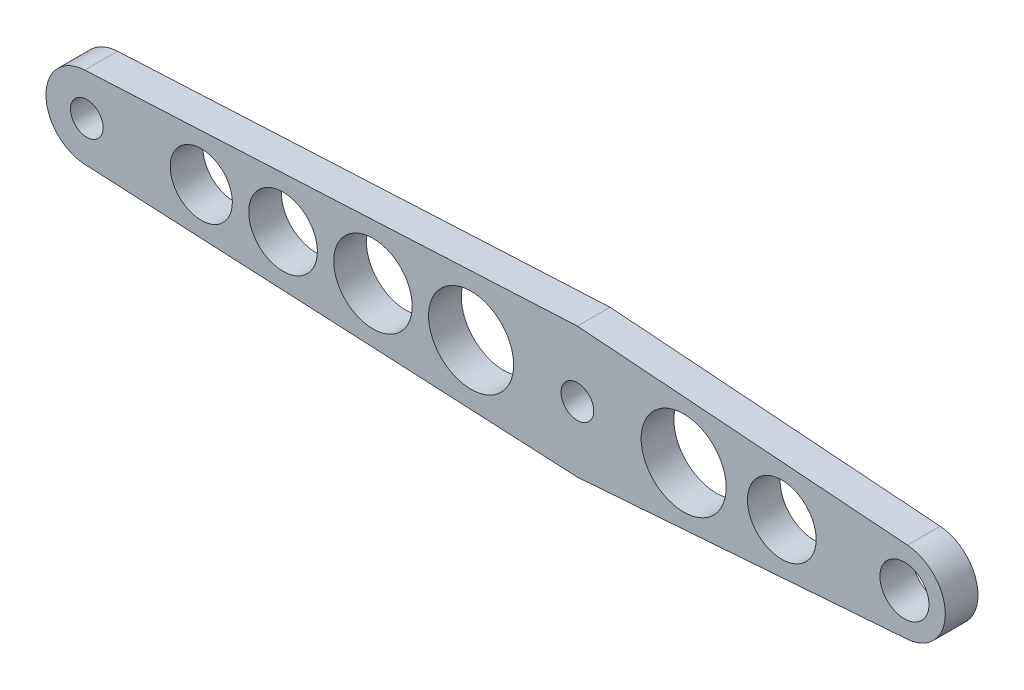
SolidWorks part; units mm, degrees
ref_plane "Front Plane" through (0, 0, 0) normal (0, 0, 1) x (1, 0, 0)
ref_plane "Top Plane" through (0, 0, 0) normal (0, 1, 0) x (1, 0, 0)
ref_plane "Right Plane" through (0, 0, 0) normal (1, 0, 0) x (0, 0, -1)
sketch "Sketch1" plane through (0, 0, 0) normal (0, 0, 1) x (1, 0, 0)
  line L0 (0, 0) -> (6406.8224, 0) construction
  line L1 (0, 0) -> (0, -6406.8224) construction
  line L3 (-30.1246, 2.4969) -> (0, 4)
  line L4 (0, 4) -> (20.1861, 2.4931)
  line L5 (-30.1246, -2.4969) -> (0, -4)
  line L6 (0, -4) -> (20.1861, -2.4931)
  circle A0 centre (0, 0) radius 1
  circle A1 centre (-30, 0) radius 1
  circle A2 centre (-23, 0) radius 1.9
  circle A3 centre (-18, 0) radius 2.1
  circle A4 centre (-12.5, 0) radius 2.4
  circle A5 centre (-6.5, 0) radius 2.6
  circle A6 centre (6.5, 0) radius 2.6
  circle A7 centre (12.5, 0) radius 2.1
  circle A8 centre (20, 0) radius 1.5
  arc A9 (-30.1246, 2.4969) -> (-30.1246, -2.4969) centre (-30, 0) ccw
  arc A10 (20.1861, 2.4931) -> (20.1861, -2.4931) centre (20, 0) cw
  dimension "D1" = 2
  dimension "D2" = 3.8
  dimension "D3" = 4.2
  dimension "D4" = 4.8
  dimension "D5" = 5.2
  dimension "D11" = 2
  dimension "D12" = 5.2
  dimension "D13" = 4.2
  dimension "D14" = 3
  dimension "D19" = 2.5
  dimension "D20" = 2.5
  dimension "D6" = 30
  dimension "D7" = 7
  dimension "D8" = 5
  dimension "D9" = 5.5
  dimension "D10" = 6
  dimension "D15" = 7.5
  dimension "D16" = 6
  dimension "D17" = 20
  dimension "D18" = 8
extrude "Boss-Extrude1" add sketch "Sketch1" along normal blind 2
